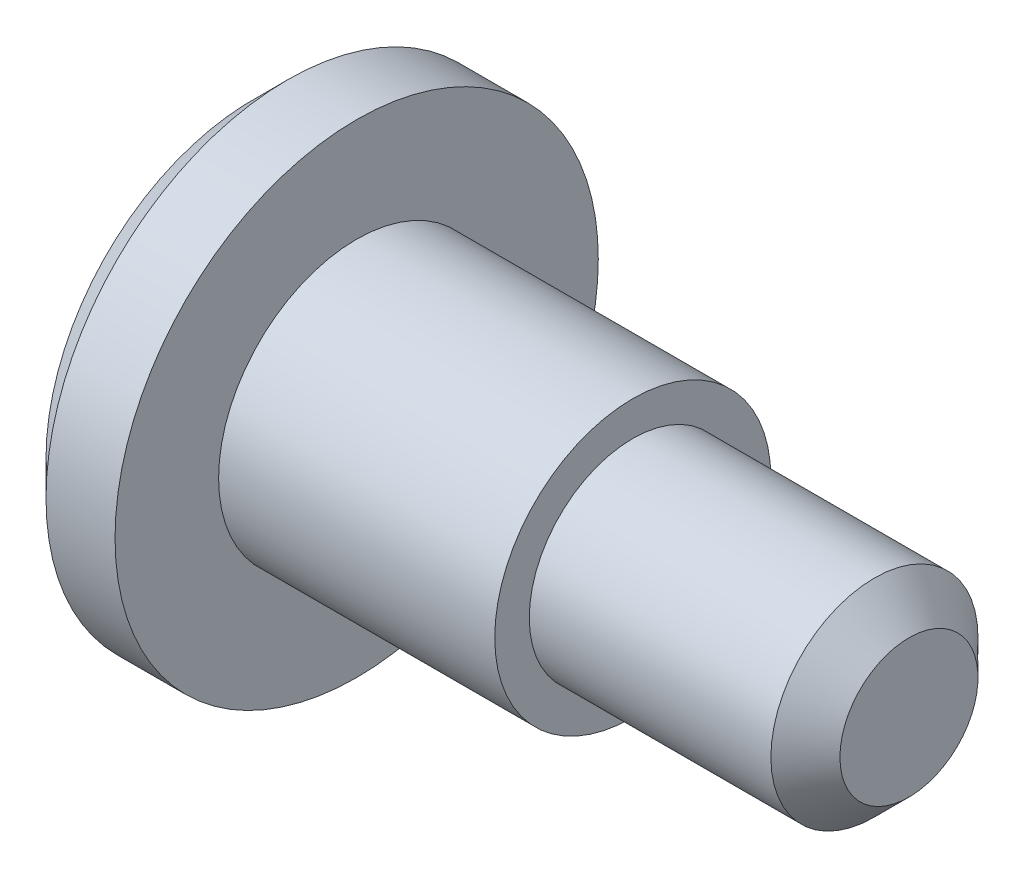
SolidWorks part; units mm, degrees
ref_plane "Přední rovina" through (0, 0, 0) normal (0, 0, 1) x (1, 0, 0)
ref_plane "Horní rovina" through (0, 0, 0) normal (0, 1, 0) x (1, 0, 0)
ref_plane "Pravá rovina" through (0, 0, 0) normal (1, 0, 0) x (0, 0, -1)
sketch "Skica1" plane through (0, 0, 0) normal (0, 0, 1) x (1, 0, 0)
  line L0 (-3.001, 0) -> (6.9673, 0) construction
  line L1 (-1.5, 0) -> (-1.5, 3.5)
  line L2 (-1.5, 3.5) -> (0, 3.5)
  line L3 (0, 3.5) -> (0, 2)
  line L4 (0, 2) -> (4, 2)
  line L5 (4, 2) -> (4, 1.5)
  line L6 (4, 1.5) -> (8, 1.5)
  line L7 (8, 1.5) -> (8, 0)
  line L8 (8, 0) -> (-1.5, 0)
  dimension "D1" = 4
  dimension "D2" = 3
  dimension "D3" = 7
  dimension "D4" = 1.5
  dimension "D5" = 4
  dimension "D6" = 4
revolve "Rotovat1" add sketch "Skica1" angle 360 about L0
chamfer "Zkosení1" distance 0.5 angle 45 2 edges at (8, 0, 1.5) (-1.5, 0, 3.5)
